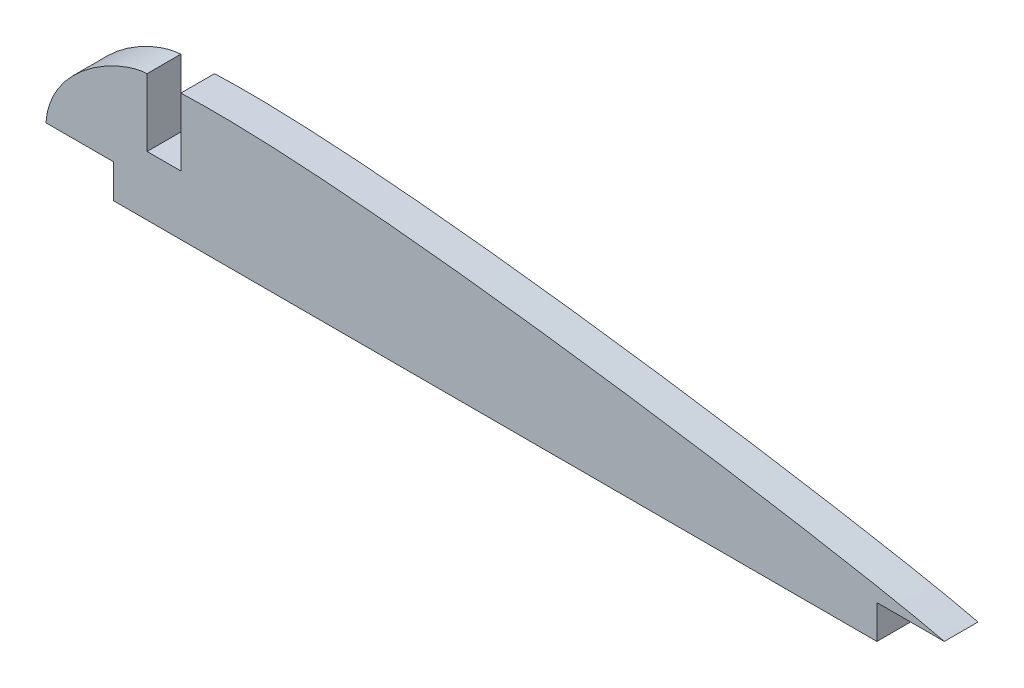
SolidWorks part; units mm, degrees
ref_plane "Front Plane" through (0, 0, 0) normal (0, 0, 1) x (1, 0, 0)
ref_plane "Top Plane" through (0, 0, 0) normal (0, 1, 0) x (1, 0, 0)
ref_plane "Right Plane" through (0, 0, 0) normal (1, 0, 0) x (0, 0, -1)
sketch "Sketch2" plane through (0, 0, 0) normal (0, 0, 1) x (1, 0, 0)
  line L0 (0, 26.7991) -> (3.175, 26.7991)
  line L1 (3.175, 26.7991) -> (3.175, 33.1491)
  line L2 (3.175, 21.1986) -> (68.7525, 21.1986)
  line L4 (-9.525, 24.3736) -> (-3.175, 24.3736)
  line L5 (0, 26.7991) -> (0, 33.1491)
  line L6 (3.175, 21.1986) -> (-3.175, 21.1986)
  line L7 (75.1025, 24.3736) -> (68.7525, 24.3736)
  line L8 (-3.175, 24.3736) -> (-3.175, 21.1986)
  line L9 (68.7525, 24.3736) -> (68.7525, 21.1986)
  spline S0 degree 3 poles (0, 33.1491) (-2.8543, 33.0274) (-9.1999, 29.454) (-9.525, 24.3736) knots 0 0 0 0 1 1 1 1
  spline S1 degree 3 poles (3.175, 33.1491) (21.697, 33.9252) (66.0369, 26.6619) (75.1025, 24.3736) knots 0 0 0 0 1 1 1 1
extrude "Boss-Extrude1" add sketch "Sketch2" along normal blind 3.175
